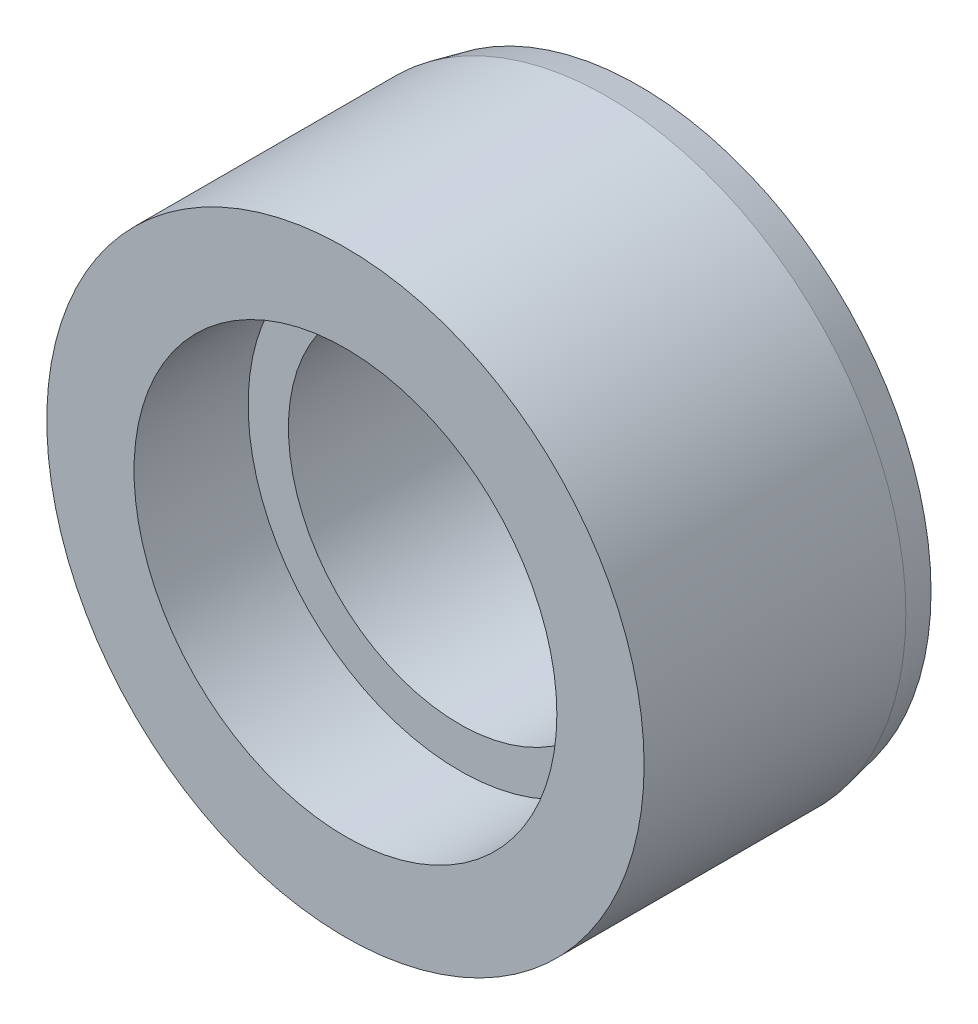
SolidWorks part; units mm, degrees
ref_plane "Front Plane" through (0, 0, 0) normal (0, 0, 1) x (1, 0, 0)
ref_plane "Top Plane" through (0, 0, 0) normal (0, 1, 0) x (1, 0, 0)
ref_plane "Right Plane" through (0, 0, 0) normal (1, 0, 0) x (0, 0, -1)
sketch "Sketch1" plane through (0, 0, 0) normal (1, 0, 0) x (0, 0, -1)
  line L0 (0, 0) -> (23.0314, 0) construction
  line L1 (0, 11.303) -> (9.906, 11.303)
  line L2 (11.1125, 11.049) -> (11.1125, 6.477)
  line L3 (11.1125, 6.477) -> (4.318, 6.477)
  line L4 (4.318, 6.477) -> (4.318, 8.001)
  line L5 (4.318, 8.001) -> (0, 8.001)
  line L6 (0, 8.001) -> (0, 11.303)
  line L7 (9.906, 11.303) -> (11.1125, 11.049)
  dimension "D6" = 9.906
  dimension "D1" = 12.954
  dimension "D2" = 22.606
  dimension "D3" = 11.1125
  dimension "D4" = 16.002
  dimension "D5" = 4.318
  dimension "D7" = 0.254
revolve "Revolve1" add sketch "Sketch1" angle 360 about L0
